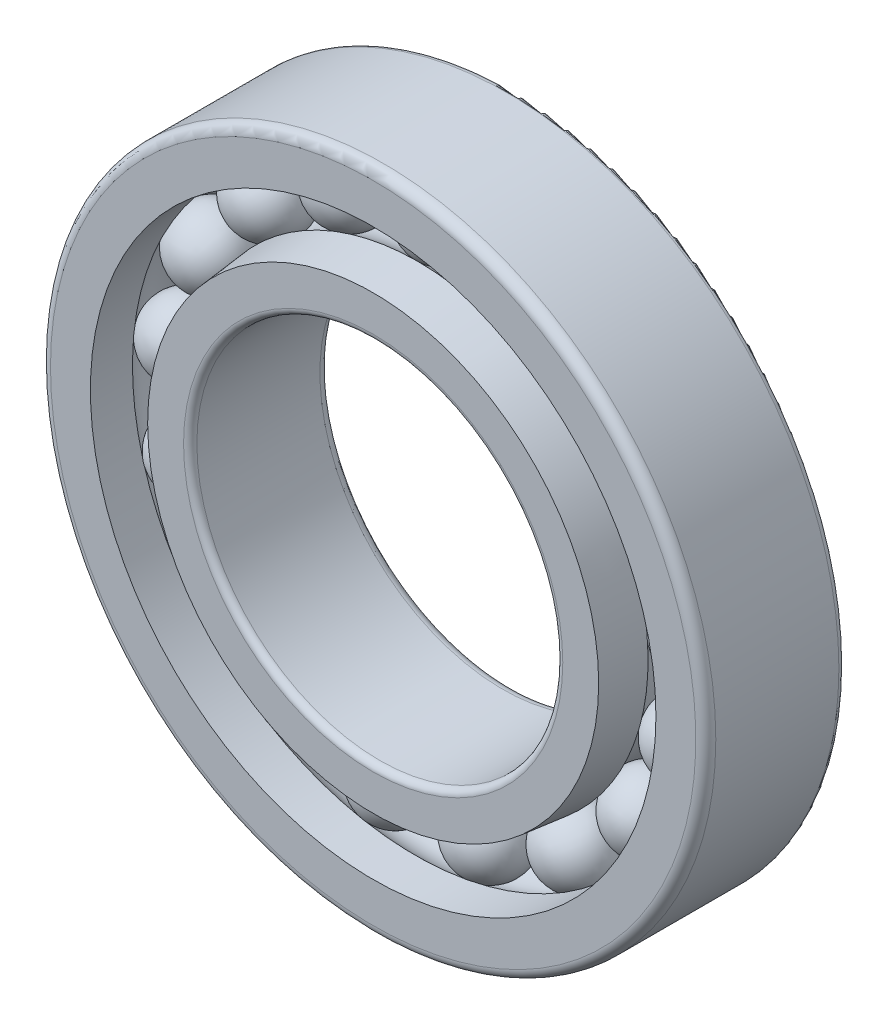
SolidWorks part; units mm, degrees
ref_plane "Front Plane" through (0, 0, 0) normal (0, 0, 1) x (1, 0, 0)
ref_plane "Top Plane" through (0, 0, 0) normal (0, 1, 0) x (1, 0, 0)
ref_plane "Right Plane" through (0, 0, 0) normal (1, 0, 0) x (0, 0, -1)
other "Configuration Table"
sketch "BaseSke" plane through (0, 0, 0) normal (1, 0, 0) x (0, 0, -1)
  line L0 (-47.2296, 0) -> (24.6132, 0) construction
  line L1 (-47.2296, 38.75) -> (24.6132, 38.75) construction
  line L2 (0, 129.5214) -> (0, -86.3012) construction
  line L3 (0, 44.375) -> (0, 33.125)
  line L4 (-10.5, 50) -> (10.5, 50) construction
  line L5 (-10.5, 27.5) -> (10.5, 27.5) construction
  arc A0 (0, 44.375) -> (0, 33.125) centre (0, 38.75) ccw
revolve "Ball" add sketch "BaseSke" angle 360 about L3
sketch "OuterRaceSke" plane through (0, 0, 0) normal (1, 0, 0) x (0, 0, -1)
  line L0 (0, 0) -> (0, 87.5396) construction
  line L1 (-10.5, 50) -> (10.5, 50)
  line L2 (-10.5, 50) -> (-10.5, 42.5)
  line L3 (-10.5, 42.5) -> (-4.1792, 42.5)
  line L4 (10.5, 50) -> (10.5, 43.6036)
  line L5 (-50.3916, 0) -> (55.2197, 0) construction
  line L6 (-47.2296, 38.75) -> (24.6132, 38.75) construction
  line L8 (10.5, 43.6036) -> (3.7847, 42.8978)
  line L9 (0, 42.5) -> (-4.1992, 58.1715) construction
  line L10 (0, 42.5) -> (3.7847, 42.8978) construction
  arc A0 (3.7847, 42.8978) -> (-4.1792, 42.5) centre (0, 38.75) ccw
revolve "OuterRace" add sketch "OuterRaceSke" angle 360 about L5
sketch "InnerRaceSke" plane through (0, 0, 0) normal (1, 0, 0) x (0, 0, -1)
  line L0 (-70.8626, 0) -> (113.5527, 0) construction
  line L1 (0, 58.441) -> (0, -70.8113) construction
  line L2 (-10.5, 27.5) -> (10.5, 27.5)
  line L3 (-10.5, 27.5) -> (-10.5, 35)
  line L4 (-10.5, 35) -> (-4.1792, 35)
  line L5 (10.5, 27.5) -> (10.5, 35)
  line L6 (0, 129.5214) -> (0, -86.3012) construction
  line L7 (4.1792, 35) -> (10.5, 35)
  arc A0 (-4.1792, 35) -> (4.1792, 35) centre (0, 38.75) ccw
  arc A1 (0, 44.375) -> (0, 33.125) centre (0, 38.75) ccw construction
revolve "InnerRace" add sketch "InnerRaceSke" angle 360 about L0
fillet "Fillet1" radius 1.5 2 edges at (27.5, 0, -10.5) (50, 0, 10.5)
fillet "Fillet2" radius 1 2 edges at (50, 0, -10.5) (27.5, 0, 10.5)
sketch "CutInnerRaceSke" plane through (0, 0, 0) normal (1, 0, 0) x (0, 0, -1)
  line L0 (-4.1792, 35) -> (-10.5, 35)
  line L1 (-10.5, 35) -> (-10.5, 33.8964)
  line L2 (-10.5, 33.8964) -> (-3.7847, 34.6022)
  line L3 (-3.7847, 34.6022) -> (0, 35) construction
  line L4 (0, 58.441) -> (0, -70.8113) construction
  line L5 (-28.3066, 0) -> (35.2466, 0) construction
  arc A0 (-4.1792, 35) -> (-3.7847, 34.6022) centre (0, 38.75) ccw
  arc A1 (-4.1792, 35) -> (4.1792, 35) centre (0, 38.75) ccw construction
revolve "CutInnerRace" cut sketch "CutInnerRaceSke" angle 360 about L5
pattern_circular "CirPatternBall" count 17 over 360 about axis through (0, 0, 0) along (0, 0, 1) of "Ball"
sketch "SimplifiedSke" plane through (0, 0, 0) normal (1, 0, 0) x (0, 0, -1)
  line L0 (37.5911, 0) -> (-37.5911, 0) construction
  circle A0 centre (0, 38.75) radius 5.625
  arc A1 (0, 44.375) -> (0, 33.125) centre (0, 38.75) ccw construction
revolve "Simplified" [suppressed] add sketch "SimplifiedSke" angle 360 about L0
equation "\"D1@BaseSke\" =  (\"Bearing_Outside_Diameter@BaseSke\"  +  \"Bearing_Inside_Diameter@BaseSke\"  )  / 4"
equation "\"Ball_diameter@BaseSke\" =  ( \"Bearing_Outside_Diameter@BaseSke\" - \"Bearing_Inside_Diameter@BaseSke\" ) / 4 "
equation "\"D2@OuterRaceSke\" = \"Bearing_Outside_Diameter@BaseSke\" -  ( \"Bearing_Outside_Diameter@BaseSke\" - \"Bearing_Inside_Diameter@BaseSke\" )  / 3"
equation "\"D4@OuterRaceSke\" = (  \"Bearing_Outside_Diameter@BaseSke\" - \"Bearing_Inside_Diameter@BaseSke\" ) / 4 -0.02"
equation "\"D3@OuterRaceSke\" = \"Angle@OuterRaceSke\"/2.5"
equation "\"D1@InnerRaceSke\" = \"Bearing_Inside_Diameter@BaseSke\" +  ( \"Bearing_Outside_Diameter@BaseSke\" - \"Bearing_Inside_Diameter@BaseSke\" )  / 3"
equation "\"D2@InnerRaceSke\" = \"D4@OuterRaceSke\""
equation "\"D1@CirPatternBall\" = int( \"D1@BaseSke\"* pi  * 2 / \"Ball_diameter@BaseSke\"/1.2 ) -1"
equation "\"D1@CutInnerRaceSke\" = \"D3@OuterRaceSke\""
